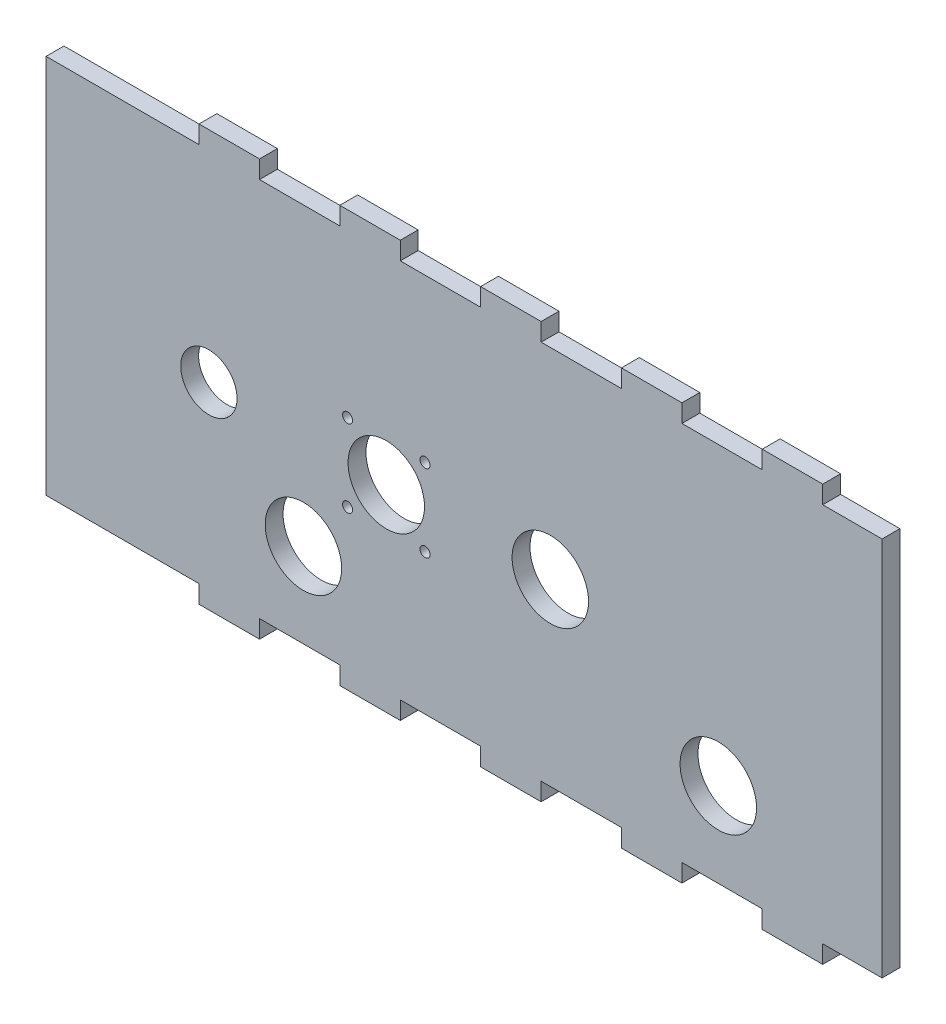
SolidWorks part; units mm, degrees
ref_plane "Front Plane" through (0, 0, 0) normal (0, 0, 1) x (1, 0, 0)
ref_plane "Top Plane" through (0, 0, 0) normal (0, 1, 0) x (1, 0, 0)
ref_plane "Right Plane" through (0, 0, 0) normal (1, 0, 0) x (0, 0, -1)
sketch "Sketch1" plane through (0, 0, 0) normal (0, 0, 1) x (1, 0, 0)
  line L0 (179.0489, 63.6704) -> (179.0489, 26.3194) construction
  line L1 (0, 0) -> (296.845, 0) construction
  line L5 (91.3825, 30) -> (238.7025, 30) construction
  line L6 (179.0489, 63.6704) -> (179.0489, 26.3194) construction
  line L7 (165.0425, 30) -> (165.0425, 0) construction
  line L8 (154.3, 0) -> (154.3, -6.35)
  line L9 (154.3, -6.35) -> (175.785, -6.35)
  line L10 (107.0601, 77.4192) -> (134.5576, 49.9216) construction
  line L11 (107.0601, 49.9216) -> (134.5576, 77.4192) construction
  line L12 (175.785, -6.35) -> (175.785, 0)
  line L13 (175.785, 0) -> (204.3, 0)
  line L16 (296.845, 135) -> (0, 135) construction
  line L17 (0, 135) -> (0, 0)
  line L18 (296.845, 135) -> (296.845, 0)
  line L19 (204.3, 0) -> (204.3, -6.35)
  line L20 (204.3, -6.35) -> (225.785, -6.35)
  line L21 (225.785, -6.35) -> (225.785, 0)
  line L22 (225.785, 0) -> (254.3, 0)
  line L23 (254.3, 0) -> (254.3, -6.35)
  line L24 (254.3, -6.35) -> (275.785, -6.35)
  line L25 (275.785, -6.35) -> (275.785, 0)
  line L26 (275.785, 0) -> (296.845, 0)
  line L27 (154.3, 0) -> (125.785, 0)
  line L28 (125.785, 0) -> (125.785, -6.35)
  line L29 (125.785, -6.35) -> (104.3, -6.35)
  line L30 (104.3, -6.35) -> (104.3, 0)
  line L31 (104.3, 0) -> (75.785, 0)
  line L32 (75.785, 0) -> (75.785, -6.35)
  line L33 (75.785, -6.35) -> (54.3, -6.35)
  line L34 (54.3, -6.35) -> (54.3, 0)
  line L35 (54.3, 0) -> (0, 0)
  line L36 (0, 67.5) -> (296.845, 67.5) construction
  line L37 (275.785, 135) -> (296.845, 135)
  line L38 (275.785, 141.35) -> (275.785, 135)
  line L39 (254.3, 141.35) -> (275.785, 141.35)
  line L40 (254.3, 135) -> (254.3, 141.35)
  line L41 (225.785, 135) -> (254.3, 135)
  line L42 (225.785, 141.35) -> (225.785, 135)
  line L43 (204.3, 141.35) -> (225.785, 141.35)
  line L44 (204.3, 135) -> (204.3, 141.35)
  line L45 (175.785, 135) -> (204.3, 135)
  line L46 (175.785, 141.35) -> (175.785, 135)
  line L47 (154.3, 141.35) -> (175.785, 141.35)
  line L48 (154.3, 135) -> (154.3, 141.35)
  line L49 (154.3, 135) -> (125.785, 135)
  line L50 (125.785, 135) -> (125.785, 141.35)
  line L51 (125.785, 141.35) -> (104.3, 141.35)
  line L52 (104.3, 141.35) -> (104.3, 135)
  line L53 (104.3, 135) -> (75.785, 135)
  line L54 (75.785, 135) -> (75.785, 141.35)
  line L55 (75.785, 141.35) -> (54.3, 141.35)
  line L56 (54.3, 141.35) -> (54.3, 135)
  line L57 (54.3, 135) -> (0, 135)
  line L58 (57.8089, 63.6704) -> (120.8089, 63.6704) construction
  circle A0 centre (91.3825, 30) radius 13.575
  circle A1 centre (238.7025, 30) radius 13.575
  circle A2 centre (179.0489, 63.6704) radius 13.575
  circle A3 centre (120.8089, 63.6704) radius 13.575
  circle A4 centre (120.8089, 63.6704) radius 19.4437 construction
  circle A5 centre (107.0601, 77.4192) radius 1.778
  circle A6 centre (107.0601, 49.9216) radius 1.778
  circle A7 centre (134.5576, 77.4192) radius 1.778
  circle A8 centre (134.5576, 49.9216) radius 1.778
  circle A9 centre (57.8089, 63.6704) radius 10
  point P43 (165.0425, -6.35)
  point P74 (120.8089, 63.6704)
  dimension "D2" = 27.15
  dimension "D3" = 58.24
  dimension "D4" = 54.3
  dimension "D9" = 38.8874
  dimension "D10" = 3.556
  dimension "D5" = 147.32
  dimension "D17" = 20
  dimension "D6" = 68.5
  dimension "D7" = 93.91
  dimension "D8" = 135
  dimension "D11" = 21.485
  dimension "D12" = 28.515
  dimension "D13" = 6.35
  dimension "D14" = 21.06
  dimension "D15" = 30
  dimension "D16" = 63
extrude "Boss-Extrude1" add sketch "Sketch1" along normal blind 6.35
